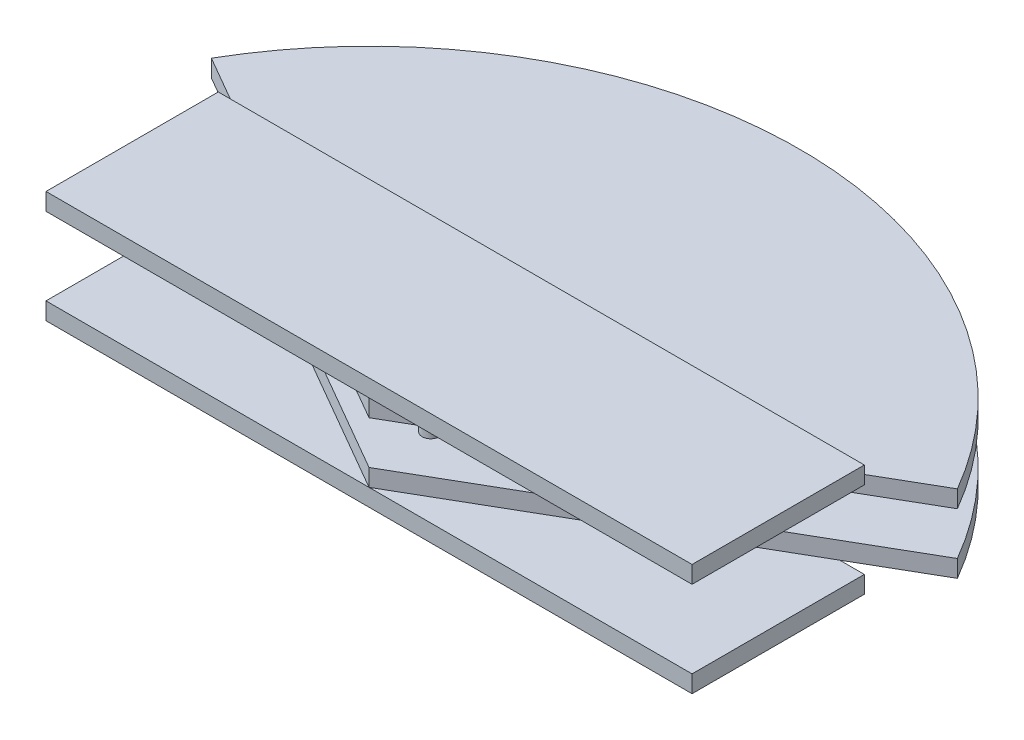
SolidWorks part; units mm, degrees
ref_plane "Front Plane" through (0, 0, 0) normal (0, 0, 1) x (1, 0, 0)
ref_plane "Top Plane" through (0, 0, 0) normal (0, 1, 0) x (1, 0, 0)
ref_plane "Right Plane" through (0, 0, 0) normal (1, 0, 0) x (0, 0, -1)
sketch "Sketch4" plane through (0, 0, 0) normal (0, 1, 0) x (1, 0, 0)
  line L0 (0, 0) -> (173.2051, 100)
  line L1 (0, 0) -> (-173.2051, 100)
  line L2 (0, 0) -> (0, 200) construction
  arc A0 (173.2051, 100) -> (-173.2051, 100) centre (0, 0) ccw
  dimension "D1" = 400
  dimension "D2" = 60
  dimension "D3" = 60
extrude "Boss-Extrude2" add sketch "Sketch4" along normal blind 8
sketch "Sketch5" plane through (0, 8, 0) normal (0, 1, 0) x (1, 0, 0)
  line L1 (-150, 0) -> (150, 0)
  line L2 (-150, 0) -> (-150, 80)
  line L3 (-150, 80) -> (150, 80)
  line L4 (150, 0) -> (150, 80)
  dimension "D1" = 300
  dimension "D2" = 80
extrude "Boss-Extrude3" add sketch "Sketch5" along normal blind 8
sketch "Sketch6" plane through (0, 0, 0) normal (0, -1, 0) x (1, 0, 0)
  circle A0 centre (0, -28.6914) radius 4
  dimension "D1" = 8
extrude "Boss-Extrude4" add sketch "Sketch6" along normal blind 20
sketch "Sketch7" plane through (0, -20, 0) normal (0, -1, 0) x (1, 0, 0)
  line L0 (0, 0) -> (-173.2051, -100)
  line L1 (-173.2051, -100) -> (0, 0) construction
  line L2 (0, 0) -> (173.2051, -100)
  arc A0 (-173.2051, -100) -> (173.2051, -100) centre (0, 0) ccw
extrude "Boss-Extrude5" add sketch "Sketch7" along normal blind 8
sketch "Sketch8" plane through (0, -28, 0) normal (0, -1, 0) x (1, 0, 0)
  line L1 (-150, -80) -> (150, -80)
  line L2 (-150, -80) -> (-150, 0)
  line L3 (-150, 0) -> (150, 0)
  line L4 (150, -80) -> (150, 0)
extrude "Boss-Extrude6" add sketch "Sketch8" along normal blind 8
